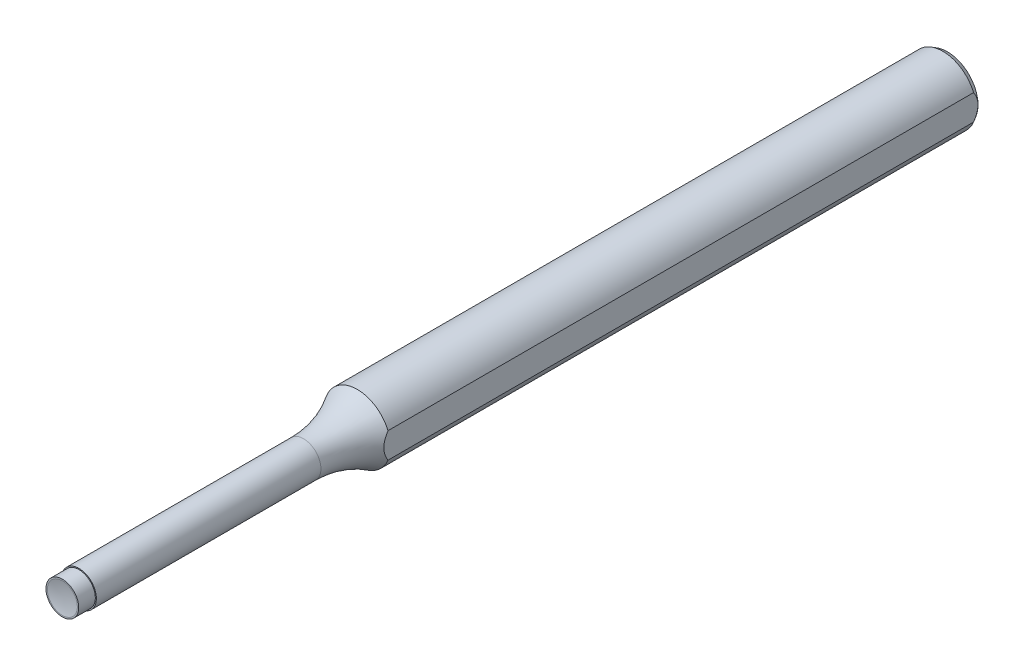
SolidWorks part; units mm, degrees
ref_plane "Front Plane" through (0, 0, 0) normal (0, 0, 1) x (1, 0, 0)
ref_plane "Top Plane" through (0, 0, 0) normal (0, 1, 0) x (1, 0, 0)
ref_plane "Right Plane" through (0, 0, 0) normal (1, 0, 0) x (0, 0, -1)
sketch "Sketch1" plane through (0, 0, 0) normal (0, 0, 1) x (1, 0, 0)
  circle A0 centre (0, 0) radius 4.765
  dimension "D1" = 9.53
extrude "Boss-Extrude1" add sketch "Sketch1" against normal blind 127
sketch "Sketch2" plane through (0, 0, 0) normal (0, 0, 1) x (1, 0, 0)
  circle A0 centre (0, 0) radius 2.5
  dimension "D1" = 5
extrude "Cut-Extrude1" cut sketch "Sketch2" against normal blind 42.3333 flip side to cut
sketch "Sketch3" plane through (0, 0, 0) normal (0, 0, 1) x (1, 0, 0)
  circle A0 centre (0, 0) radius 2.35
  dimension "D1" = 4.7
extrude "Cut-Extrude2" cut sketch "Sketch3" against normal blind 2.3825 flip side to cut
sketch "Sketch4" plane through (0, 0, 0) normal (1, 0, 0) x (0, 0, -1)
  line L0 (0, 0) -> (0, 2.15)
  line L1 (0, 2.35) -> (0, -2.35) construction
  line L2 (0.2457, 0) -> (0.2457, 2.15) construction
  line L3 (0, 0) -> (0.2457, 0)
  line L4 (0, 0) -> (0, -2.15) construction
  arc A0 (0.2457, 0) -> (0, 2.15) centre (-9.2843, 0) ccw
  dimension "D2" = 9.53
  dimension "D1" = 4.3
revolve "Cut-Revolve1" cut sketch "Sketch4" angle 360 about L3
chamfer "Chamfer1" distance 0.6353 angle 30 1 edges at (4.765, 0, -127)
sketch "Sketch5" plane through (0, 0, 0) normal (1, 0, 0) x (0, 0, -1)
  line L0 (42.3333, 0) -> (34.6115, 0)
  line L1 (42.3333, 4.765) -> (42.3333, -4.765) construction
  line L2 (34.6115, 0) -> (34.6115, 2.5)
  line L3 (42.3333, 2.5) -> (2.3825, 2.5) construction
  line L4 (42.3333, 4.765) -> (42.3333, 0)
  line L5 (34.6115, 2.5) -> (42.3333, 2.5) construction
  arc A0 (34.6115, 2.5) -> (42.3333, 4.765) centre (34.6115, 16.795) ccw
  dimension "D1" = 14.295
revolve "Revolve1" add sketch "Sketch5" angle 360 about L0
sketch "Sketch6" plane through (0, 0, 0) normal (1, 0, 0) x (0, 0, -1)
  line L0 (84.6667, 0) -> (98.9617, 0)
  line L1 (84.6667, 0) -> (84.6667, 9.53)
  line L2 (84.6667, 9.53) -> (90.7084, 9.53)
  line L3 (98.9617, 0) -> (98.9617, 4.765)
  line L4 (126.3647, 4.765) -> (42.3333, 4.765) construction
  line L5 (98.9617, 4.765) -> (84.6667, 4.765) construction
  line L6 (127, -4.765) -> (127, 4.765) construction
  arc A0 (98.9617, 4.765) -> (90.7084, 9.53) centre (98.9617, 14.295) cw
  dimension "D2" = 9.53
  dimension "D1" = 42.3333
  dimension "D3" = 14.295
revolve "Revolve2" [suppressed] add sketch "Sketch6" angle 360 about L0
sketch "Sketch7" plane through (0, 0, -127) normal (0, 0, -1) x (-1, 0, 0)
  line L9 (-8.0649, 1.8333) -> (-4.3982, 1.8333)
  line L10 (-8.0649, 1.8333) -> (-8.0649, -1.8333)
  line L11 (-8.0649, -1.8333) -> (-4.3982, -1.8333)
  line L12 (-4.3982, 1.8333) -> (-4.3982, -1.8333)
  circle A5 centre (0, 0) radius 4.765 construction
  circle A6 centre (0, 0) radius 4.3982 construction
  point P8 (-4.3982, 0)
extrude "Cut-Extrude3" cut sketch "Sketch7" against normal through all
